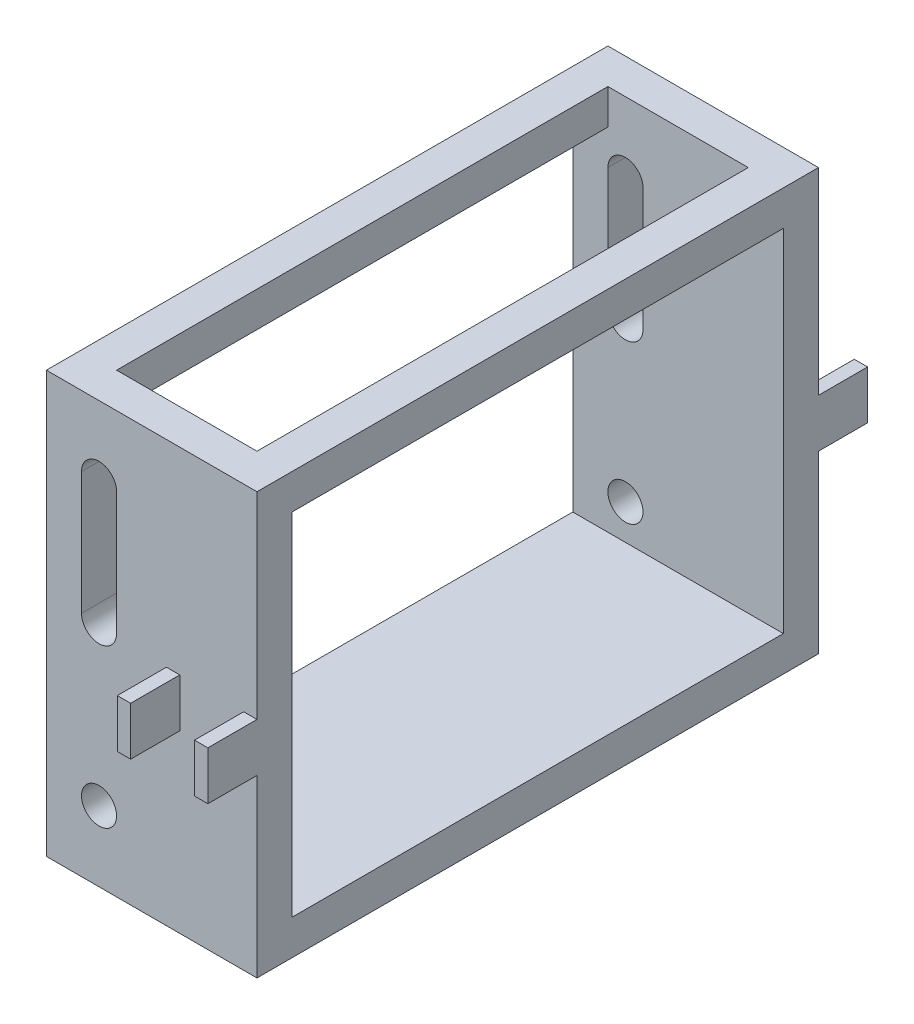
SolidWorks part; units mm, degrees
ref_plane "Front Plane" through (0, 0, 0) normal (0, 0, 1) x (1, 0, 0)
ref_plane "Top Plane" through (0, 0, 0) normal (0, 1, 0) x (1, 0, 0)
ref_plane "Right Plane" through (0, 0, 0) normal (1, 0, 0) x (0, 0, -1)
sketch "Sketch1" plane through (0, 0, 0) normal (0, 1, 0) x (1, 0, 0)
  line L1 (0, 0) -> (76.2, 0)
  line L2 (0, 0) -> (0, 203.2)
  line L3 (0, 203.2) -> (76.2, 203.2)
  line L4 (76.2, 0) -> (76.2, 203.2)
  dimension "D1" = 203.2
  dimension "D2" = 76.2
extrude "Boss-Extrude1" add sketch "Sketch1" along normal blind 12.7
sketch "Sketch2" plane through (0, 12.7, 0) normal (0, 1, 0) x (1, 0, 0)
  line L0 (76.2, 0) -> (76.2, 203.2) construction
  line L1 (0, 203.2) -> (76.2, 203.2)
  line L2 (0, 203.2) -> (0, 190.5)
  line L3 (0, 190.5) -> (76.2, 190.5)
  line L4 (76.2, 203.2) -> (76.2, 190.5)
  line L5 (0, 203.2) -> (0, 0) construction
  line L6 (76.2, 0) -> (0, 0)
  line L7 (76.2, 0) -> (76.2, 12.7)
  line L8 (76.2, 12.7) -> (0, 12.7)
  line L9 (0, 0) -> (0, 12.7)
  dimension "D1" = 12.7
  dimension "D2" = 12.7
extrude "Boss-Extrude2" add sketch "Sketch2" along normal blind 127
sketch "Sketch3" plane through (0, 139.7, 0) normal (0, 1, 0) x (1, 0, 0)
  line L0 (0, 203.2) -> (0, 0)
  line L1 (0, 0) -> (76.2, 0)
  line L2 (76.2, 0) -> (76.2, 203.2)
  line L3 (76.2, 203.2) -> (0, 203.2)
  line L4 (0, 190.5) -> (76.2, 190.5) construction
  line L5 (12.7, 190.5) -> (63.5, 190.5)
  line L6 (12.7, 190.5) -> (12.7, 12.7)
  line L7 (12.7, 12.7) -> (63.5, 12.7)
  line L8 (63.5, 190.5) -> (63.5, 12.7)
  line L9 (76.2, 12.7) -> (0, 12.7) construction
  dimension "D1" = 12.7
  dimension "D2" = 12.7
extrude "Boss-Extrude3" add sketch "Sketch3" along normal blind 12.7
sketch "Sketch4" plane through (0, 0, 0) normal (0, 0, 1) x (1, 0, 0)
  line L0 (0, 152.4) -> (0, 0) construction
  line L1 (0, 152.4) -> (76.2, 152.4) construction
  line L2 (0, 0) -> (76.2, 0) construction
  line L3 (12.7, 127) -> (12.7, 82.55)
  line L4 (25.4, 127) -> (25.4, 82.55)
  arc A0 (25.4, 127) -> (12.7, 127) centre (19.05, 127) ccw
  arc A1 (12.7, 82.55) -> (25.4, 82.55) centre (19.05, 82.55) ccw
  circle A2 centre (19.05, 25.4) radius 6.35
  dimension "D1" = 12.7
  dimension "D2" = 19.05
  dimension "D3" = 25.4
  dimension "D4" = 25.4
  dimension "D5" = 44.45
extrude "Cut-Extrude1" cut sketch "Sketch4" against normal through all
sketch "Sketch5" plane through (0, 0, 0) normal (0, 0, 1) x (1, 0, 0)
  line L0 (76.2, 152.4) -> (76.2, 0) construction
  line L1 (71.374, 81.026) -> (76.2, 81.026)
  line L2 (71.374, 81.026) -> (71.374, 63.5)
  line L3 (71.374, 63.5) -> (76.2, 63.5)
  line L4 (76.2, 81.026) -> (76.2, 63.5)
  line L5 (48.26, 81.026) -> (43.434, 81.026)
  line L6 (48.26, 81.026) -> (48.26, 63.5)
  line L7 (48.26, 63.5) -> (43.434, 63.5)
  line L8 (43.434, 81.026) -> (43.434, 63.5)
  line L9 (0, 0) -> (76.2, 0) construction
  dimension "D1" = 17.526
  dimension "D2" = 23.114
  dimension "D3" = 4.826
  dimension "D4" = 81.026
extrude "Boss-Extrude4" add sketch "Sketch5" along normal blind 17.78
ref_plane "Plane1" [suppressed] through (0, 0, -101.6) normal (0, 0, 1) x (1, 0, 0)
mirror "Mirror1" about plane through (0, 0, -101.6) normal (0, 0, 1) of "Boss-Extrude4"
